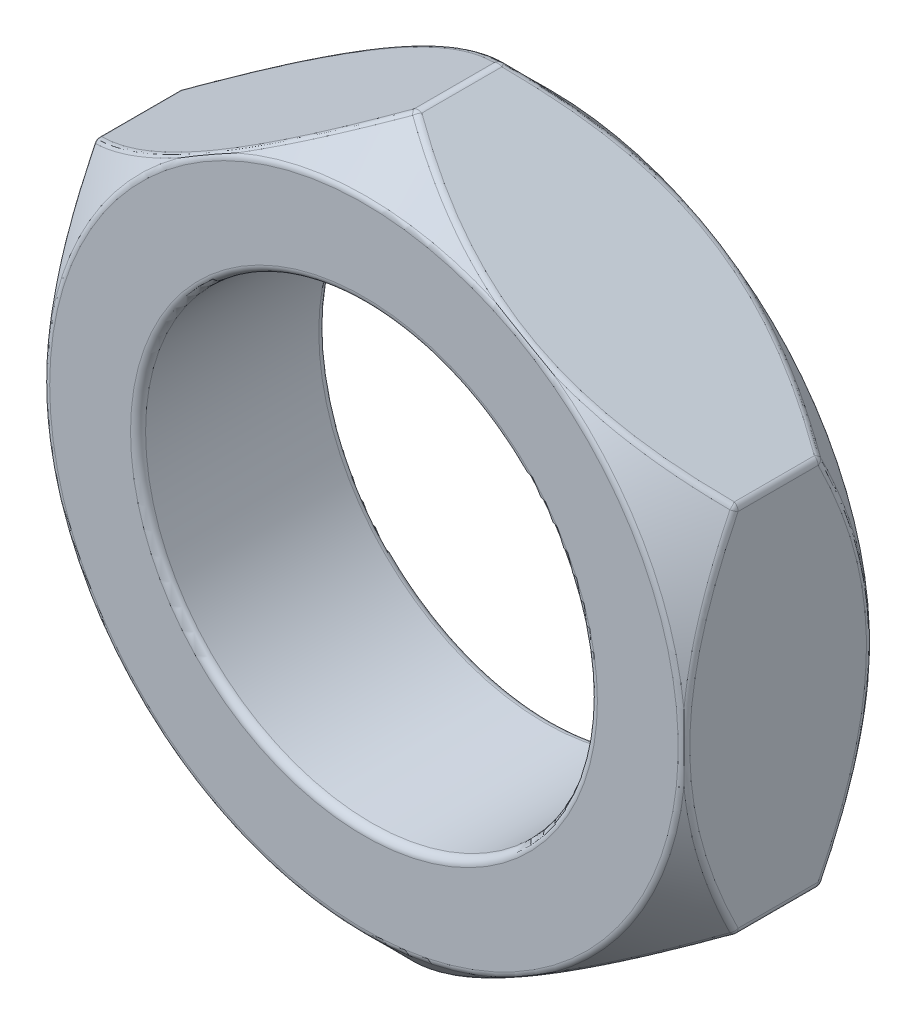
SolidWorks part; units mm, degrees
ref_plane "Plan1" through (0, 0, 0) normal (0, 0, 1) x (1, 0, 0)
ref_plane "Plan2" through (0, 0, 0) normal (0, 1, 0) x (1, 0, 0)
ref_plane "Plan3" through (0, 0, 0) normal (1, 0, 0) x (0, 0, -1)
sketch "Esquisse1" plane through (0, 0, 0) normal (0, 0, 1) x (1, 0, 0)
  line L1 (0, 9.815) -> (-8.5, 4.9075)
  line L2 (-8.5, 4.9075) -> (-8.5, -4.9075)
  line L3 (-8.5, -4.9075) -> (0, -9.815)
  line L4 (0, -9.815) -> (8.5, -4.9075)
  line L5 (8.5, -4.9075) -> (8.5, 4.9075)
  line L6 (8.5, 4.9075) -> (0, 9.815)
  circle A0 centre (0, 0) radius 8.5 construction
  dimension "D1" = 17
extrude "Extrusion1" add sketch "Esquisse1" along normal mid plane 5
hole_wizard "Trou taraudé M12x1.751" positions "Esquisse3" profile "Esquisse2" tap size "M12x1.75" standard "ISO"
sketch "Esquisse3" plane through (0, 0, 2.5) normal (0, 0, 1) x (1, 0, 0)
  point P0 (0, 0)
sketch "Esquisse2" plane through (0, 0, 2.5) normal (1, 0, 0) x (0, -1, 0)
  line L0 (0, 0) -> (0, 35.8144)
  line L1 (0, 35.8144) -> (5.1, 32.75)
  line L2 (5.1, 32.75) -> (5.1, 24)
  line L3 (5.1, 24) -> (6, 24)
  line L4 (6, 24) -> (6, 0)
  line L5 (6, 0) -> (0, 0)
  line L10 (0, 35.8144) -> (-5.1, 32.75) construction
  line L11 (0, -6.35) -> (0, 107.95) construction
  dimension "Diamètre du trou pour taraudage" = 10.2
  dimension "Profondeur du trou pour taraudage" = 32.75
  dimension "Diamètre principal du filetage" = 12
  dimension "Profondeur du filetage" = 24
  dimension "Angle de pointe" = 118
sketch "Esquisse5" plane through (0, 0, 0) normal (1, 0, 0) x (0, 0, -1)
  line L0 (-3.1795, 7.75) -> (-0.1849, 10.7445)
  line L1 (-0.1849, 10.7445) -> (-3.1795, 10.7445)
  line L2 (-3.1795, 10.7445) -> (-3.1795, 7.75)
  line L3 (-2.5, 9.815) -> (2.5, 9.815) construction
  line L4 (0, 0) -> (-4.5694, 0) construction
  dimension "D1" = 45
  dimension "D2" = 7.75
revolve "Enlèvement de matière-Révolution1" cut sketch "Esquisse5" angle 360 about L4
mirror "Symétrie1" about plane through (0, 0, 0) normal (0, 0, 1)
fillet "Congé1" radius 0.2
